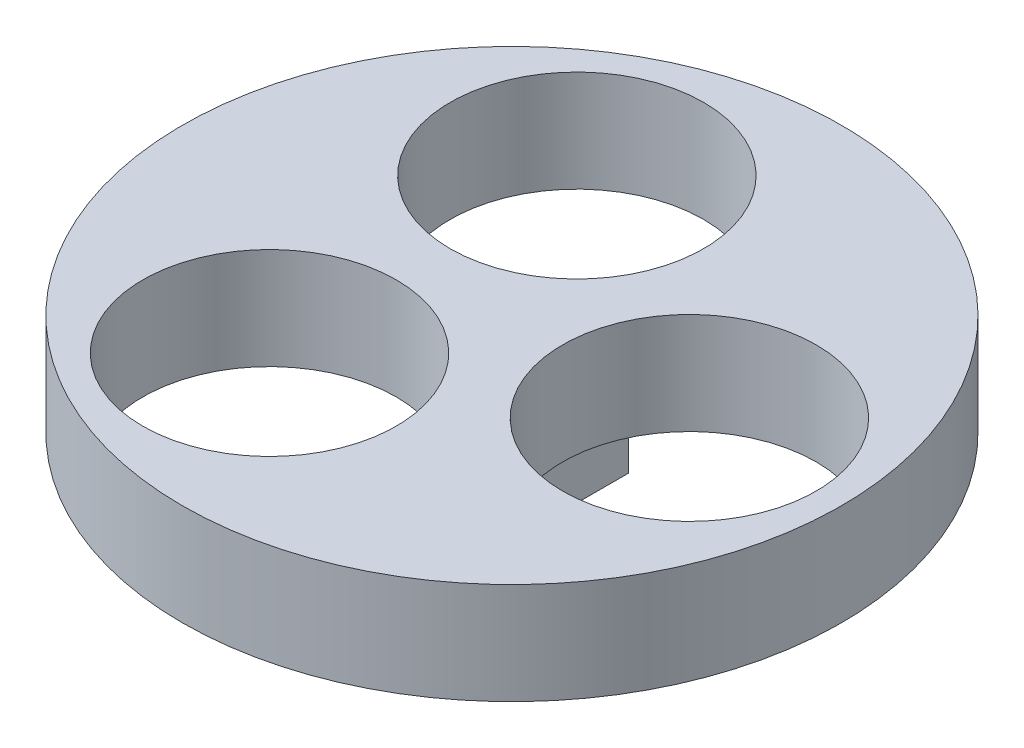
SolidWorks part; units mm, degrees
ref_plane "Plan de face" through (0, 0, 0) normal (0, 0, 1) x (1, 0, 0)
ref_plane "Plan de dessus" through (0, 0, 0) normal (0, 1, 0) x (1, 0, 0)
ref_plane "Plan de droite" through (0, 0, 0) normal (1, 0, 0) x (0, 0, -1)
sketch "Esquisse1" plane through (0, 0, 0) normal (0, 1, 0) x (1, 0, 0)
  circle A0 centre (0, 0) radius 3.5 construction
  circle A1 centre (3.5, 0) radius 2.5
  circle A2 centre (-1.75, -3.0311) radius 2.5
  circle A3 centre (-1.75, 3.0311) radius 2.5
  circle A4 centre (0, 0) radius 6.5
  dimension "D1" = 7
  dimension "D2" = 13
extrude "Extrusion1" add sketch "Esquisse1" along normal blind 2
sketch "Esquisse2" plane through (0, 0, 0) normal (0, 1, 0) x (-1, 0, 0)
  line L0 (-0.8429, -1.46) -> (-0.8429, 1.46)
  line L1 (-0.8429, 1.46) -> (1.6859, 0)
  line L2 (1.6859, 0) -> (-0.8429, -1.46)
  line L3 (-3.5, 0) -> (3.9577, 0) construction
  line L4 (-0.8429, 1.46) -> (0.3928, -0.6803) construction
  dimension "D1" = 60
  dimension "D2" = 60
extrude "Extrusion2" add sketch "Esquisse2" against normal blind 1
